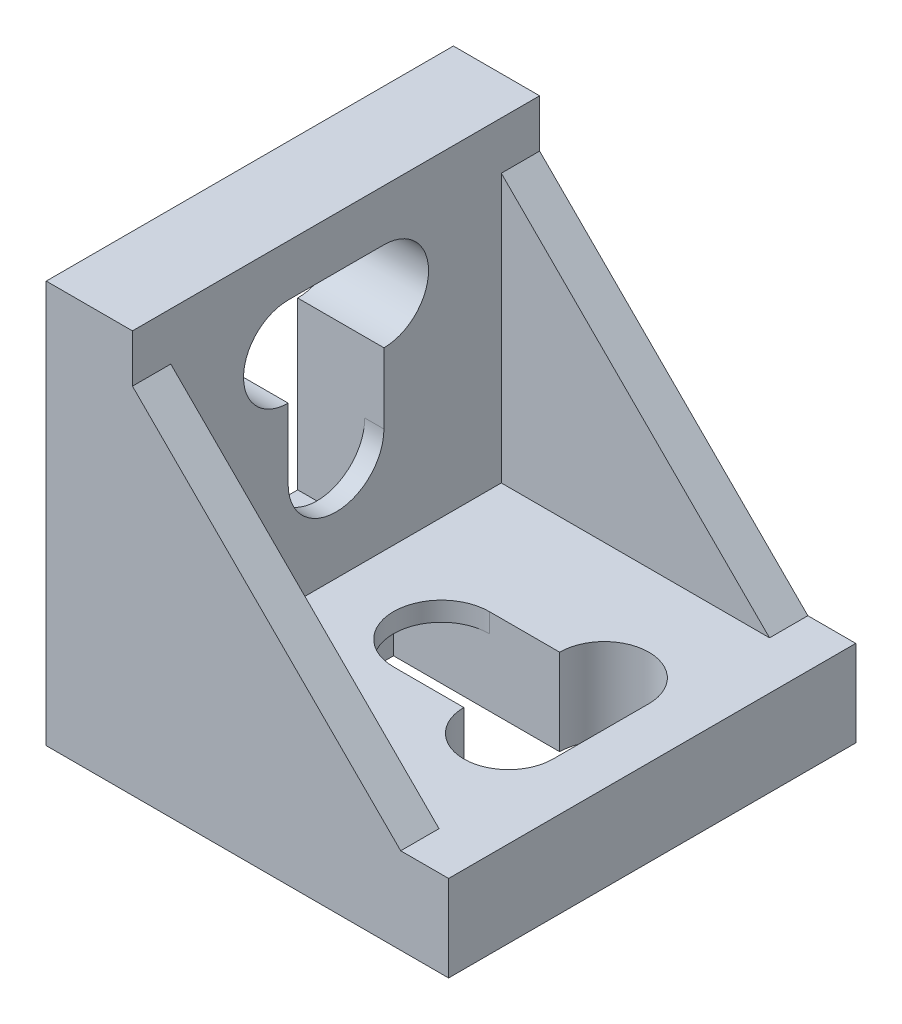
SolidWorks part; units mm, degrees
ref_plane "前视基准面" through (0, 0, 0) normal (0, 0, 1) x (1, 0, 0)
ref_plane "上视基准面" through (0, 0, 0) normal (0, 1, 0) x (1, 0, 0)
ref_plane "右视基准面" through (0, 0, 0) normal (1, 0, 0) x (0, 0, -1)
sketch "草图1" plane through (0, 0, 0) normal (0, 0, 1) x (1, 0, 0)
  line L0 (0, 42) -> (9, 42)
  line L1 (9, 42) -> (9, 9)
  line L2 (9, 9) -> (42, 9)
  line L3 (42, 9) -> (42, 0)
  line L4 (42, 0) -> (0, 0)
  line L5 (0, 0) -> (0, 42)
  dimension "D1" = 9
  dimension "D2" = 9
  dimension "D3" = 42
  dimension "D4" = 42
extrude "凸台-拉伸1" add sketch "草图1" along normal mid plane 42.5
sketch "草图2" plane through (0, 0, 21.25) normal (0, 0, 1) x (1, 0, 0)
  line L0 (9, 37) -> (37, 9)
  line L1 (9, 9) -> (9, 42) construction
  line L2 (42, 9) -> (9, 9) construction
  line L3 (37, 9) -> (9, 9)
  line L4 (9, 9) -> (9, 37)
  dimension "D1" = 5
  dimension "D2" = 5
extrude "凸台-拉伸2" add sketch "草图2" against normal blind 4
mirror "镜向1" about plane through (0, 0, 0) normal (0, 0, 1) of "凸台-拉伸2"
sketch "草图3" plane through (0, 0, 0) normal (-1, 0, 0) x (0, 0, 1)
  line L0 (0, 42) -> (0, 0) construction
  line L1 (21.25, 42) -> (-21.25, 42) construction
  line L2 (-5, 32) -> (5, 32) construction
  line L3 (-5, 36.6562) -> (5, 36.6562)
  line L4 (-5, 27.3438) -> (5, 27.3438)
  line L7 (21.25, 42) -> (21.25, 0) construction
  arc A0 (-5, 36.6562) -> (-5, 27.3438) centre (-5, 32) ccw
  arc A1 (5, 27.3438) -> (5, 36.6562) centre (5, 32) ccw
  point P7 (0, 32)
  dimension "D1" = 10
  dimension "D2" = 21.25
  dimension "D3" = 16.25
extrude "切除-拉伸1" cut sketch "草图3" against normal through all
sketch "草图4" plane through (0, 0, 0) normal (-1, 0, 0) x (0, 0, 1)
  line L0 (0, 30) -> (0, 20) construction
  line L1 (5, 30) -> (5, 20)
  line L2 (-5, 30) -> (-5, 20)
  arc A0 (5, 30) -> (-5, 30) centre (0, 30) ccw
  arc A1 (-5, 20) -> (5, 20) centre (0, 20) ccw
  point P3 (0, 25)
  dimension "D3" = 5
  dimension "D1" = 10
  dimension "D2" = 20
extrude "切除-拉伸2" cut sketch "草图4" against normal through all
sketch "草图5" plane through (0, 0, 0) normal (-1, 0, 0) x (0, 0, 1)
  line L0 (-18.25, 40) -> (-8.75, 40)
  line L1 (-8.75, 40) -> (-8.75, 38.4952)
  line L2 (-18.25, 40) -> (-18.25, 5.3389)
  line L3 (-18.25, 5.3389) -> (-8.75, 5.3389)
  line L4 (-8.75, 5.3389) -> (-8.75, 25.5048)
  line L5 (21.25, 42) -> (-21.25, 42) construction
  line L6 (-21.25, 42) -> (-21.25, 0) construction
  circle A0 centre (-5, 32) radius 7.5
  circle A1 centre (5, 32) radius 7.5
  dimension "D1" = 15
  dimension "D2" = 15
  dimension "D3" = 2
  dimension "D4" = 3
  dimension "D5" = 9.5
  dimension "D6" = 9.5
extrude "切除-拉伸3" cut sketch "草图5" against normal blind 7 contours A0 L1 L0 L2 L3 L4
mirror "镜向2" about plane through (0, 0, 0) normal (0, 0, 1) of "切除-拉伸3"
sketch "草图6" plane through (0, 0, 0) normal (-1, 0, 0) x (0, 0, 1)
  line L0 (-5, 23.6719) -> (-5, 10)
  line L1 (-5, 27.3438) -> (-5, 20) construction
  line L2 (-5, 10) -> (5, 10)
  line L3 (5, 10) -> (5, 23.6719)
  line L4 (5, 20) -> (5, 27.3438) construction
  line L5 (5, 23.6719) -> (-5, 23.6719)
  line L6 (21.25, 0) -> (-21.25, 0) construction
  dimension "D1" = 10
  dimension "D2" = 10
extrude "切除-拉伸4" cut sketch "草图6" against normal blind 7
sketch "草图7" plane through (0, 0, 0) normal (-1, 0, 0) x (0, 0, 1)
  line L0 (0, 36.6562) -> (4.9, 36.6562)
  line L1 (5, 36.6562) -> (-5, 36.6562) construction
  line L2 (4.9, 36.6562) -> (4.9, 38.6562)
  line L3 (4.9, 38.6562) -> (-4.9, 38.6562)
  line L4 (-4.9, 38.6562) -> (-4.9, 36.6562)
  line L5 (-4.9, 36.6562) -> (0, 36.6562)
  line L6 (-4.9, 8.1125) -> (4.9, 8.1125)
  line L8 (4.9, 8.1125) -> (4.9, 6.1125)
  line L9 (4.9, 6.1125) -> (-4.9, 6.1125)
  line L10 (-4.9, 6.1125) -> (-4.9, 8.1125)
  dimension "D1" = 9.8
  dimension "D2" = 2
  dimension "D3" = 9.8
  dimension "D4" = 2
  dimension "D5" = 4.9
  dimension "D6" = 4.9
extrude "凸台-拉伸3" add sketch "草图7" along normal blind 2
ref_plane "基准面1" through (0, 0, 0) normal (-0.7071, 0.7071, 0) x (-0.7071, -0.7071, 0)
mirror "镜向3" about plane through (0, 0, 0) normal (-0.7071, 0.7071, 0) of "切除-拉伸2"
mirror "镜向4" about plane through (0, 0, 0) normal (-0.7071, 0.7071, 0) of "切除-拉伸1"
mirror "镜向5" about plane through (0, 0, 0) normal (-0.7071, 0.7071, 0) of "切除-拉伸4"
mirror "镜向6" about plane through (0, 0, 0) normal (-0.7071, 0.7071, 0) of "切除-拉伸3"
mirror "镜向7" about plane through (0, 0, 0) normal (-0.7071, 0.7071, 0) of "镜向2"
mirror "镜向8" about plane through (0, 0, 0) normal (-0.7071, 0.7071, 0) of "凸台-拉伸3"
chamfer "倒角2" distance 4 angle 45 1 edges at (5.3389, 0, -13.5)
chamfer "倒角3" distance 4 angle 45 1 edges at (5.3389, 0, 13.5)
chamfer "倒角4" distance 4 angle 45 1 edges at (0, 5.3389, -13.5)
chamfer "倒角5" distance 4 angle 45 1 edges at (0, 5.3389, 13.5)
sketch "草图11" plane through (0, 0, 18.25) normal (0, 0, -1) x (-1, 0, 0)
  line L0 (-1.3389, 0) -> (-5.3389, 4)
  line L1 (-5.3389, 4) -> (-8.3389, 7)
  line L2 (-40, 7) -> (-7, 7) construction
  line L3 (-8.3389, 7) -> (-7, 7)
  line L5 (-5.3389, 4) -> (-5.3389, 5.3389)
  line L6 (-4, 5.3389) -> (-5.3389, 5.3389)
  line L7 (-7, 8.3389) -> (-7, 7)
  line L8 (-4, 5.3389) -> (-7, 8.3389)
extrude "凸台-拉伸5" add sketch "草图11" along normal up to surface (9.5 mm away) contours L8 L1 M2 M6 M7 M1
sketch "草图12" plane through (0, 0, -8.75) normal (0, 0, -1) x (-1, 0, 0)
  line L0 (-1.3389, 0) -> (-5.3389, 4)
  line L1 (-5.3389, 4) -> (-8.3389, 7)
  line L2 (-7, 7) -> (-25.5048, 7) construction
  line L3 (-8.3389, 7) -> (-7, 7)
  line L5 (-5.3389, 5.3389) -> (-5.3389, 4)
  line L6 (-5.3389, 5.3389) -> (-4, 5.3389)
  line L7 (-7, 8.3389) -> (-7, 7)
  line L8 (-4, 5.3389) -> (-7, 8.3389)
extrude "凸台-拉伸6" add sketch "草图12" along normal up to surface (9.5 mm away) contours L8 L1 M2 M6 M7 M1
